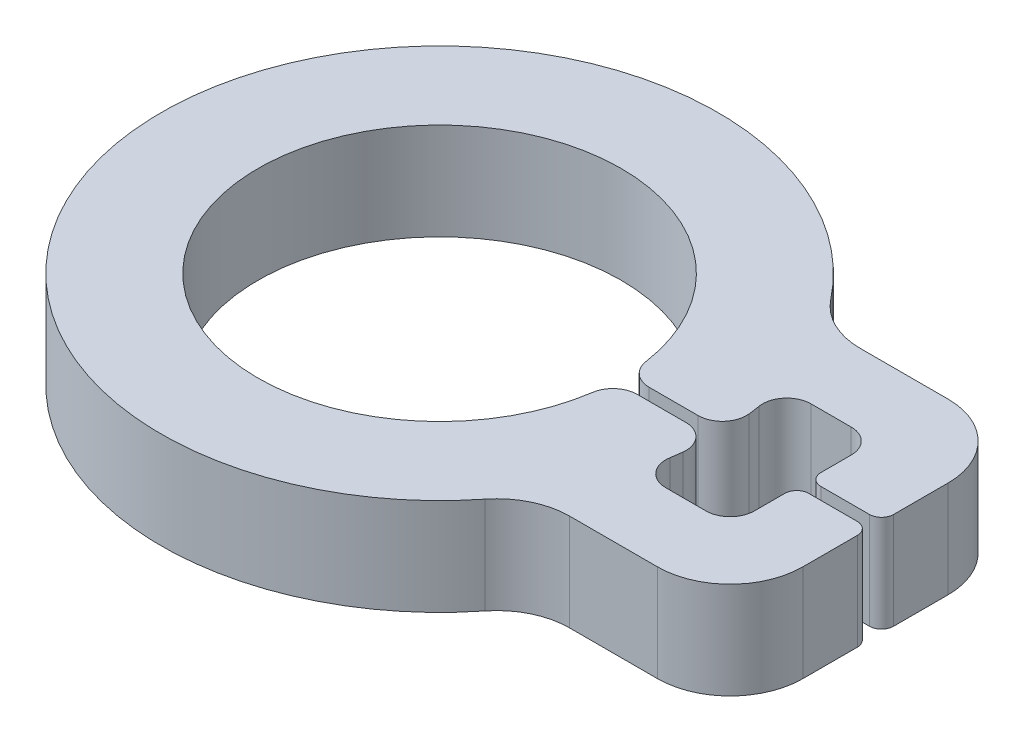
SolidWorks part; units mm, degrees
ref_plane "Front Plane" through (0, 0, 0) normal (0, 0, 1) x (1, 0, 0)
ref_plane "Top Plane" through (0, 0, 0) normal (0, 1, 0) x (1, 0, 0)
ref_plane "Right Plane" through (0, 0, 0) normal (1, 0, 0) x (0, 0, -1)
sketch "Sketch1" plane through (0, 0, 0) normal (0, 1, 0) x (1, 0, 0)
  line L0 (9.8107, 6) -> (18, 6)
  line L1 (18, 6) -> (18, 0.25)
  line L2 (18, 0.25) -> (15, 0.25)
  line L3 (15, 0.25) -> (15, 3)
  line L4 (15, 3) -> (11.1018, 3)
  line L5 (0, 0) -> (37.0474, 0) construction
  line L6 (18, -6) -> (18, -0.25)
  line L7 (12.1629, 2.0076) -> (14.1629, 2.0076) construction
  line L8 (12.1629, 2.0076) -> (12.1629, -1.9924) construction
  line L9 (12.1629, -1.9924) -> (14.1629, -1.9924) construction
  line L10 (14.1629, 2.0076) -> (14.1629, -1.9924) construction
  line L11 (9.8107, -6) -> (18, -6)
  line L12 (15, -3) -> (11.1018, -3)
  line L13 (15, -0.25) -> (15, -3)
  line L14 (18, -0.25) -> (15, -0.25)
  line L15 (7.4958, 0.25) -> (11.4973, 0.25)
  line L16 (7.4958, -0.25) -> (11.4973, -0.25)
  arc A0 (7.4958, 0.25) -> (7.4958, -0.25) centre (0, 0) ccw
  arc A1 (9.8107, 6) -> (9.8107, -6) centre (0, 0) ccw
  arc A2 (11.1018, -3) -> (11.4973, -0.25) centre (0, 0) ccw
  arc A3 (11.4973, 0.25) -> (11.1018, 3) centre (0, 0) ccw
  dimension "D1" = 3
  dimension "D6" = 15
  dimension "D7" = 4
  dimension "D2" = 3
  dimension "D3" = 15
  dimension "D4" = 6
  dimension "D5" = 5.75
  dimension "D8" = 4
  dimension "D9" = 2
  dimension "D10" = 0.25
extrude "Boss-Extrude1" add sketch "Sketch1" along normal blind 4
fillet "Fillet1" radius 1 4 edges at (7.4958, 2, 0.25) (7.4958, 2, -0.25) (11.4973, 2, 0.25) (11.4973, 2, -0.25)
fillet "Fillet2" radius 1 4 edges at (11.1018, 2, 3) (15, 2, 3) (15, 2, -3) (11.1018, 2, -3)
fillet "Fillet3" radius 0.5 4 edges at (18, 2, 0.25) (18, 2, -0.25) (15, 2, 0.25) (15, 2, -0.25)
fillet "Fillet4" radius 3 4 edges at (9.8107, 2, 6) (9.8107, 2, -6) (18, 2, 6) (18, 2, -6)
